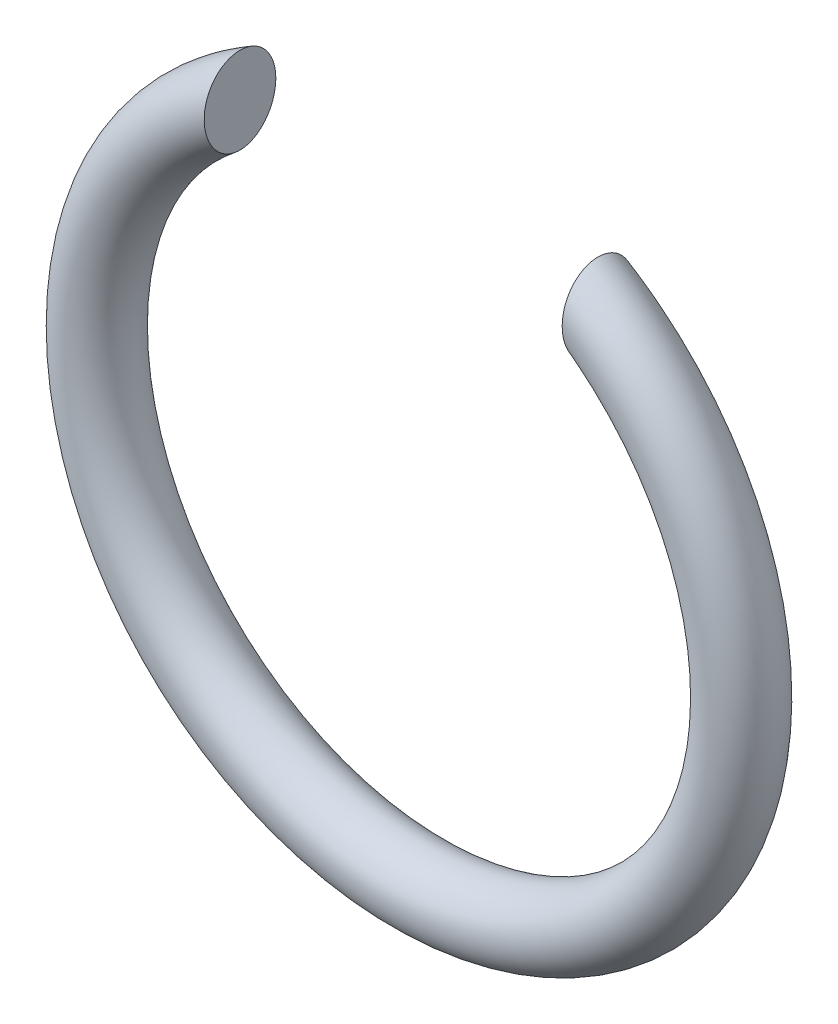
SolidWorks part; units mm, degrees
ref_plane "Front" through (0, 0, 0) normal (0, 0, 1) x (1, 0, 0)
ref_plane "Top" through (0, 0, 0) normal (0, 1, 0) x (1, 0, 0)
ref_plane "Right" through (0, 0, 0) normal (1, 0, 0) x (0, 0, -1)
other "Configuration Table"
sketch "Sketch1" plane through (0, 0, 0) normal (0, 0, 1) x (1, 0, 0)
  circle A1 centre (0, 0) radius 3.6
  dimension "D1" = 7.2
sketch "Sketch2" plane through (0, 0, 0) normal (0, 1, 0) x (1, 0, 0)
  circle A0 centre (3.6, 0) radius 0.4
  dimension "d1" = 0.8
sweep "Base-Sweep" add profiles "Sketch2" path "Sketch1"
sketch "Sketch3" plane through (0, 0, 0) normal (0, 0, 1) x (1, 0, 0)
  line L1 (-2, 0) -> (2, 0)
  line L2 (-2, 0) -> (-2, 4)
  line L3 (-2, 4) -> (2, 4)
  line L4 (2, 0) -> (2, 4)
extrude "Cut-Extrude1" cut sketch "Sketch3" against normal through all and the other way through all
equation "\"B/2@Sketch3\" = \"B@Sketch3\" / 2"
